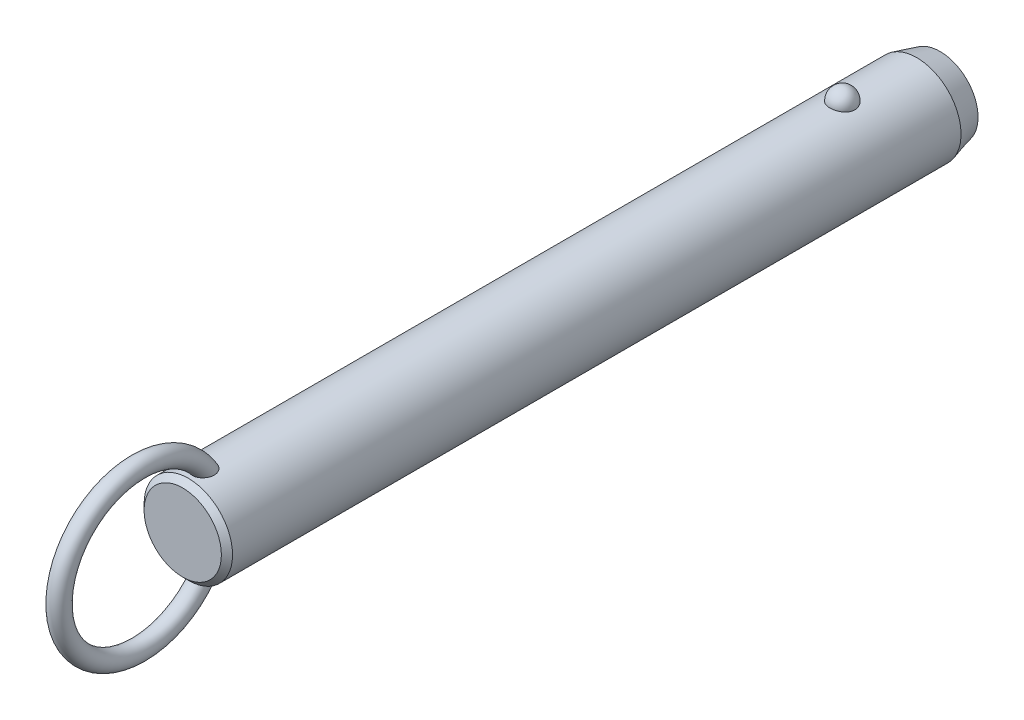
SolidWorks part; units mm, degrees
ref_plane "Front Plane" through (0, 0, 0) normal (0, 0, 1) x (1, 0, 0)
ref_plane "Top Plane" through (0, 0, 0) normal (0, 1, 0) x (1, 0, 0)
ref_plane "Right Plane" through (0, 0, 0) normal (1, 0, 0) x (0, 0, -1)
sketch "Sketch2" plane through (0, 0, 0) normal (0, 0, 1) x (1, 0, 0)
  circle A0 centre (0, 0) radius 9.5
  point P3 (0, 9.5)
  dimension "D1" = 19
extrude "Boss-Extrude1" add sketch "Sketch2" along normal blind 129.5
sketch "Sketch3" plane through (0, 0, 0) normal (0, 0, -1) x (-1, 0, 0)
  circle A0 centre (0, 0) radius 9.5
  dimension "D1" = 19
extrude "Boss-Extrude2" add sketch "Sketch3" along normal blind 23.7
chamfer "Chamfer1" distance 5 angle 15 1 edges at (-9.5, 0, -23.7)
sketch "Sketch12" plane through (0, 0, 0) normal (1, 0, 0) x (0, 0, -1)
  line L0 (-129.5, 9.5) -> (-129.5, -9.5) construction
  point P0 (-129.5, 0)
sketch "Sketch13" plane through (0, 0, 0) normal (1, 0, 0) x (0, 0, -1)
  circle A0 centre (-148.55, 0) radius 19.05
  point P2 (-129.5, 0)
  dimension "D1" = 38.1
sketch "Sketch14" plane through (0, 0, 0) normal (0, 1, 0) x (1, 0, 0)
  circle A0 centre (0, -131.5) radius 2
  point P2 (0, -129.5)
  dimension "D1" = 4
sweep "Sweep1" add profiles "Sketch14" path "Sketch13"
sketch "Sketch15" plane through (0, 0, 129.5) normal (0, 0, 1) x (1, 0, 0)
  circle A0 centre (0, 0) radius 9.5
  dimension "D1" = 19
extrude "Boss-Extrude3" add sketch "Sketch15" along normal blind 9.52
chamfer "Chamfer2" distance 1.2 angle 45 1 edges at (9.5, 0, 139.02)
sketch "Sketch18" plane through (0, 0, 0) normal (1, 0, 0) x (0, 0, -1)
  line L0 (18.7, 9.5) -> (-132.0378, 9.5) construction
  line L1 (2.7, 12.2) -> (2.7, 6.8)
  line L2 (-132.0378, -9.5) -> (18.7, -9.5) construction
  arc A0 (2.7, 12.2) -> (2.7, 6.8) centre (2.7, 9.5) ccw
  point P4 (0, 9.5)
  dimension "D1" = 21.7
revolve "Revolve1" add sketch "Sketch18" angle 360 about L1
